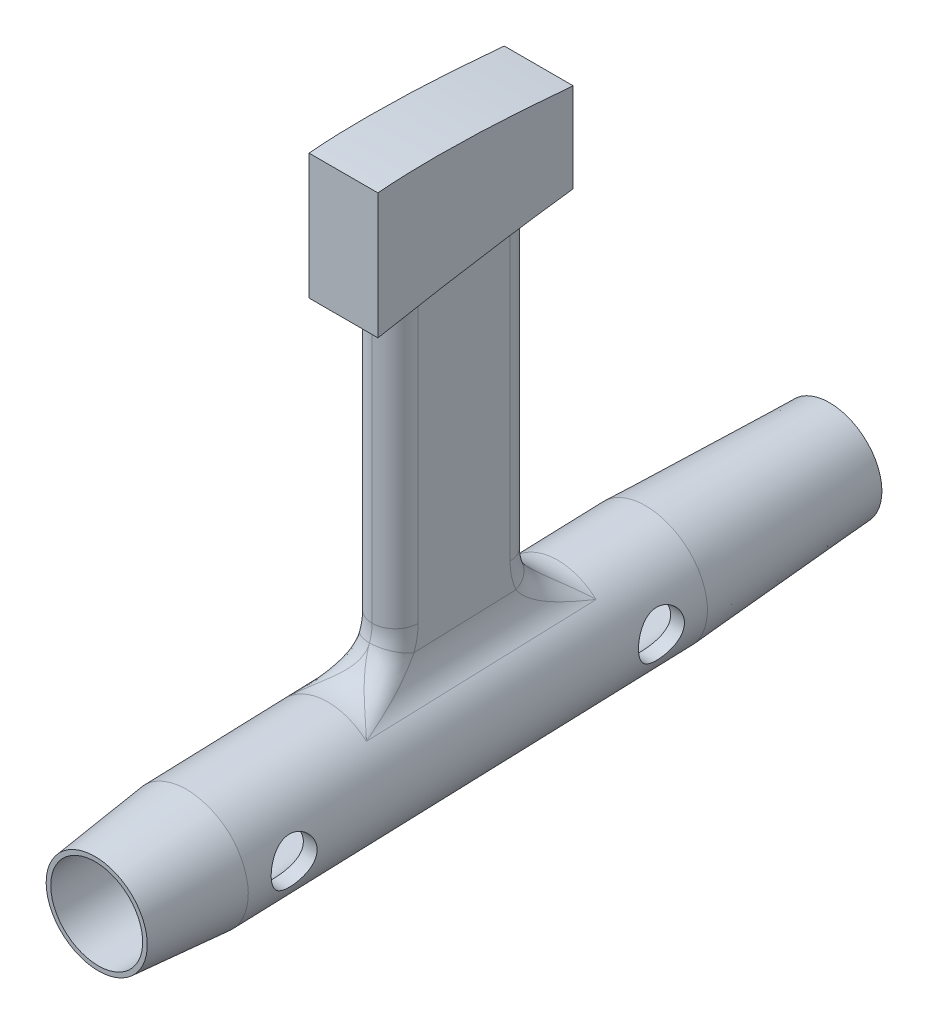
SolidWorks part; units mm, degrees
ref_plane "Front Plane" through (0, 0, 0) normal (0, 0, 1) x (1, 0, 0)
ref_plane "Top Plane" through (0, 0, 0) normal (0, 1, 0) x (1, 0, 0)
ref_plane "Right Plane" through (0, 0, 0) normal (1, 0, 0) x (0, 0, -1)
curve "Curve1"
sketch "Sketch1" plane through (0, 0, 0) normal (1, 0, 0) x (0, 0, -1)
  line L1 (0, 0) -> (0, 95.7684) construction
  line L2 (36.5125, 19.4825) -> (36.5125, 2.1283)
  line L3 (63.5, 18.8083) -> (63.5, 6.4745)
  spline S0 degree 3 poles (63.5, 18.8083) (62.6475, 18.8859) (60.0791, 19.1105) (55.8474, 19.4276) (50.8648, 19.6931) (46.0697, 19.8087) (41.4867, 19.7981) (38.3249, 19.6366) (36.6955, 19.4987) (36.5125, 19.4825) knots 1.279493 1.279493 1.279493 1.279493 1.287887 1.304773 1.321101 1.336806 1.3518 1.366031 1.367832 1.367832 1.367832 1.367832
  spline S1 degree 3 poles (36.5125, 2.1283) (37.8143, 2.3724) (41.0984, 2.9823) (46.473, 3.938) (52.7259, 4.9663) (58.4366, 5.8126) (62.0594, 6.2928) (63.5, 6.4745) knots 0.636069 0.636069 0.636069 0.636069 0.649056 0.668822 0.689595 0.71119 0.725427 0.725427 0.725427 0.725427
  dimension "D2" = 36.5125
  dimension "D3" = 63.5
extrude "Boss-Extrude1" add sketch "Sketch1" along normal blind 9.525
ref_plane "Plane1" through (0, -50.8, 0) normal (0, 1, 0) x (1, 0, 0)
sketch "Sketch2" plane through (0, -50.8, 0) normal (0, 1, 0) x (1, 0, 0)
  line L0 (4.7625, 33.1057) -> (4.7625, 69.2208) construction
  line L1 (7.9375, 40.4812) -> (1.5875, 40.4812)
  line L2 (7.9375, 40.4812) -> (7.9375, 59.5312)
  line L3 (7.9375, 59.5312) -> (1.5875, 59.5312)
  line L4 (1.5875, 40.4812) -> (1.5875, 59.5312)
  line L5 (29.9689, 50.0062) -> (-20.236, 50.0062) construction
  line L6 (9.525, 36.5125) -> (0, 36.5125) construction
  line L7 (9.525, 63.5) -> (0, 63.5) construction
  line L8 (0, 36.5125) -> (0, 63.5) construction
  line L9 (9.525, 36.5125) -> (9.525, 63.5) construction
  point P8 (4.7625, 40.4812)
  point P9 (7.9375, 50.0062)
  point P18 (4.7625, 63.5)
  point P19 (0, 50.0062)
  dimension "D1" = 6.35
  dimension "D2" = 19.05
extrude "Boss-Extrude2" add sketch "Sketch2" along normal up to surface (53.6634 mm away)
sketch "Sketch3" plane through (1.5875, 0, 0) normal (-1, 0, 0) x (0, 0, 1)
  line L0 (-40.4812, -50.8) -> (-59.5312, -50.8) construction
  line L1 (-40.4812, -50.8) -> (-59.5312, -50.1348) construction
  line L2 (-59.5312, 5.9508) -> (-59.5312, -50.8) construction
  dimension "D1" = 2
ref_plane "Plane2" through (1.5875, -50.8, -40.4812) normal (0, 0.0349, -0.9994) x (-1, 0, 0)
sketch "Sketch4" plane through (1.5875, -50.8, -40.4812) normal (0, 0.0349, -0.9994) x (-1, 0, 0)
  line L0 (0, 0) -> (-6.35, 0) construction
  circle A0 centre (-3.175, 0) radius 6.35
  circle A1 centre (-3.175, 0) radius 8.255
  dimension "D1" = 12.7
  dimension "D2" = 16.51
extrude "Boss-Extrude3" add sketch "Sketch4" along normal blind 38.1
sketch "Sketch5" plane through (0, 1.35, -38.6601) normal (0, -0.0349, 0.9994) x (1, 0, 0)
  circle A1 centre (4.7625, -52.1818) radius 8.255
  circle A2 centre (4.7625, -52.1818) radius 8.255
  circle A3 centre (4.7625, -52.1818) radius 6.35
  circle A4 centre (4.7625, -52.1818) radius 6.35
  dimension "D1" = 0
  dimension "D2" = 0
extrude "Boss-Extrude4" add sketch "Sketch5" along normal blind 25.4
fillet "Fillet1" radius 6.35 4 edges at (4.7625, -41.8747, -59.5312) (1.5875, -42.8427, -50.0063) (4.7625, -42.54, -40.4812) (7.9375, -42.8427, -50.0063)
fillet "Fillet2" radius 3.175 12 edges at (1.2677, -40.9622, -61.9718) (1.5875, -37.8847, -59.9146) (8.2573, -40.9622, -61.9718) (7.9375, -36.8976, -59.6488) (8.2506, -41.7656, -38.3777) (7.9375, -38.9914, -40.0986) (1.2744, -41.7656, -38.3777) (1.5875, -37.5747, -40.4311) (1.5875, -14.8489, -59.5312) (7.9375, -14.8489, -59.5313) (7.9375, -16.9469, -40.4812) (1.5875, -16.9469, -40.4812)
ref_plane "Plane3" through (0, 0.0204, -0.5833) normal (0, -0.0349, 0.9994) x (1, 0, 0)
sketch "Sketch7" plane through (0, 0.0204, -0.5833) normal (0, -0.0349, 0.9994) x (1, 0, 0)
  line L0 (4.7625, -27.5363) -> (4.7625, -12.1775) construction
  line L1 (12.3197, -52.1818) -> (-4.162, -52.1818) construction
  circle A0 centre (4.7625, -52.1818) radius 8.255 construction
  circle A1 centre (4.7625, -52.1818) radius 6.985
  dimension "D1" = 13.97
sketch "Sketch8" plane through (0, 0.4636, -13.2756) normal (0, -0.0349, 0.9994) x (1, 0, 0)
  line L0 (-4.607, -52.1818) -> (14.7186, -52.1818) construction
  line L1 (5.0558, -30.3475) -> (5.0558, -74.0162) construction
  point P5 (5.0558, -52.1818)
  point P6 (5.0558, -52.1818)
sketch3d "3DSketch2"
  line L0 (5.0558, -51.6864, -15.0967) -> (4.7625, -52.1297, -2.4045)
  line L1 (-4.607, -51.6864, -15.0967) -> (14.7186, -51.6864, -15.0967) construction
sketch "Sketch9" plane through (0, 0.4636, -13.2756) normal (0, -0.0349, 0.9994) x (1, 0, 0)
  circle A0 centre (4.7625, -52.1818) radius 8.255 construction
  circle A1 centre (4.7625, -52.1818) radius 8.255
loft "Loft3" add profiles "Sketch9", "Sketch7"
ref_plane "Plane4" through (0, 3.5662, -102.1214) normal (0, 0.0349, -0.9994) x (-1, 0, 0)
sketch "Sketch11" plane through (0, 3.5662, -102.1214) normal (0, 0.0349, -0.9994) x (-1, 0, 0)
  circle A1 centre (-4.7625, -52.1818) radius 6.985
  circle A2 centre (-4.7625, -52.1818) radius 6.985
  dimension "D1" = 0
sketch "Sketch12" plane through (0, 2.6797, -76.7369) normal (0, 0.0349, -0.9994) x (-1, 0, 0)
  circle A0 centre (-4.7625, -52.1818) radius 8.255 construction
  circle A1 centre (-4.7625, -52.1818) radius 8.255
loft "Loft4" add profiles "Sketch12", "Sketch11"
sketch "Sketch13" plane through (0, 3.5662, -102.1214) normal (0, 0.0349, -0.9994) x (-1, 0, 0)
  circle A0 centre (-4.7625, -52.1818) radius 6.35
  dimension "D1" = 12.7
extrude "Cut-Extrude4" cut sketch "Sketch13" against normal through all both and the other way through all
sketch "Sketch15" plane through (0, 0, 0) normal (1, 0, 0) x (0, 0, -1)
  line L0 (2.4045, -52.1297) -> (103.9426, -48.5839) construction
  line L1 (2.1607, -45.1489) -> (2.6482, -59.1104) construction
  line L2 (104.1642, -54.93) -> (103.721, -42.2378) construction
  circle A0 centre (21.4429, -51.4648) radius 3.175
  circle A1 centre (72.2119, -49.6919) radius 3.175
  dimension "D1" = 6.35
  dimension "D2" = 6.35
  dimension "D3" = 50.8
  dimension "D4" = 19.05
extrude "Cut-Extrude5" cut sketch "Sketch15" against normal through all both and the other way through all
